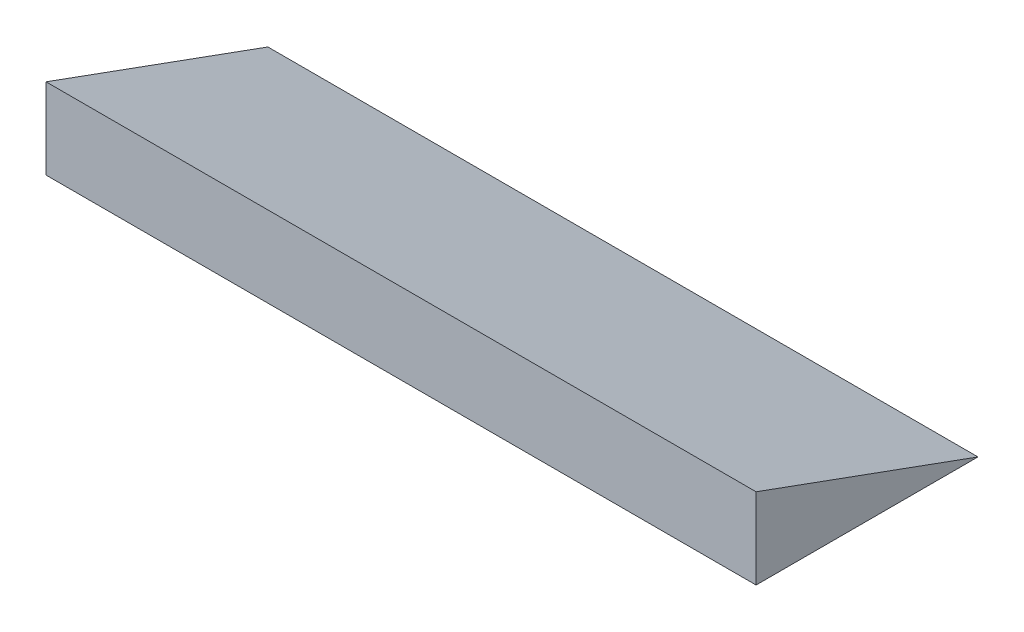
SolidWorks part; units mm, degrees
ref_plane "Plan de face" through (0, 0, 0) normal (0, 0, 1) x (1, 0, 0)
ref_plane "Plan de dessus" through (0, 0, 0) normal (0, 1, 0) x (1, 0, 0)
ref_plane "Plan de droite" through (0, 0, 0) normal (1, 0, 0) x (0, 0, -1)
sketch "Esquisse1" plane through (0, 0, 0) normal (1, 0, 0) x (0, 0, -1)
  line L0 (0, 0) -> (500, 0)
  line L1 (500, 0) -> (0, 181.9851)
  line L2 (0, 0) -> (0, 181.9851)
  dimension "D1" = 20
  dimension "D2" = 500
extrude "Boss.-Extru.1" add sketch "Esquisse1" along normal blind 1600
sketch "Esquisse2" plane through (0, 0, 0) normal (0, -1, 0) x (1, 0, 0)
  line L0 (800, -500) -> (800, 0) construction
  line L1 (1600, -500) -> (0, -500) construction
  line L2 (1600, 0) -> (0, 0) construction
  line L3 (800, -250) -> (258.9561, -250) construction
  circle A0 centre (550, -250) radius 5
  circle A1 centre (1050, -250) radius 5
  dimension "D1" = 250
extrude "Enlèv. mat.-Extru.1" cut sketch "Esquisse2" against normal blind 10
